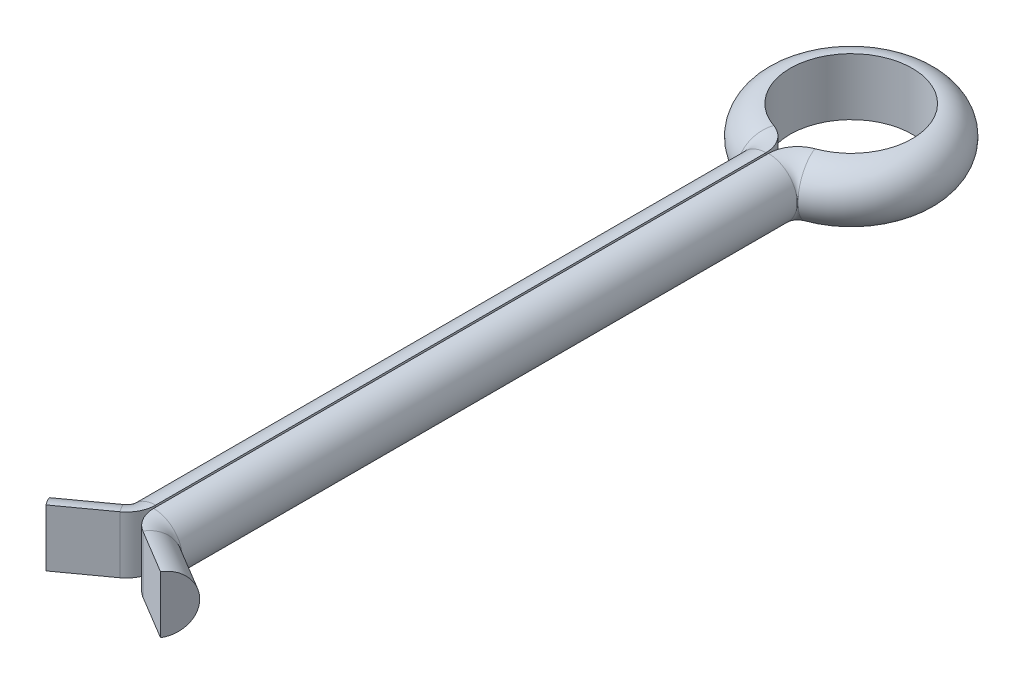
SolidWorks part; units mm, degrees
ref_plane "Face" through (0, 0, 0) normal (0, 0, 1) x (1, 0, 0)
ref_plane "Dessus" through (0, 0, 0) normal (0, 1, 0) x (1, 0, 0)
ref_plane "Droite" through (0, 0, 0) normal (1, 0, 0) x (0, 0, -1)
sketch "Esquisse2" plane through (0, 0, 0) normal (0, 1, 0) x (1, 0, 0)
  line L0 (0, 1.5327) -> (0, 64.4972)
  line L1 (-1.242, -0.8982) -> (-5.6722, -4.102)
  line L2 (0.2, 64.5679) -> (0.2, 1.1332)
  line L3 (1.6582, -1.4402) -> (6.2048, -4.1642)
  arc A0 (2.1677, 67.3847) -> (-2.0323, 67.3368) centre (0, 73.3) ccw
  arc A1 (1.6582, -1.4402) -> (0.2, 1.1332) centre (3.2, 1.1332) cw
  arc A2 (-1.242, -0.8982) -> (0, 1.5327) centre (-3, 1.5327) ccw
  arc A3 (0, 64.4972) -> (-2.0323, 67.3368) centre (-3, 64.4972) ccw
  arc A4 (0.2, 64.5679) -> (2.1677, 67.3847) centre (3.2, 64.5679) cw
  point P10 (0.2, -0.5666)
  point P13 (0, 0)
  point P16 (0, 67)
  dimension "D1" = 12.6
  dimension "D6" = 3
  dimension "D2" = 67
  dimension "D3" = 7
  dimension "D4" = 0.2
  dimension "D5" = 7
ref_plane "Plan1" through (6.2048, 0, 4.1642) normal (0.8578, 0, 0.5139) x (0.5139, 0, -0.8578)
sketch "Esquisse3" plane through (6.2048, 0, 4.1642) normal (0.8578, 0, 0.5139) x (0.5139, 0, -0.8578)
  line L0 (0, 2.95) -> (0, -2.95)
  arc A0 (0, -2.95) -> (0, 2.95) centre (0, 0) ccw
  dimension "D1" = 2.95
sweep "Balayage3" add profiles "Esquisse3" path "Esquisse2"
